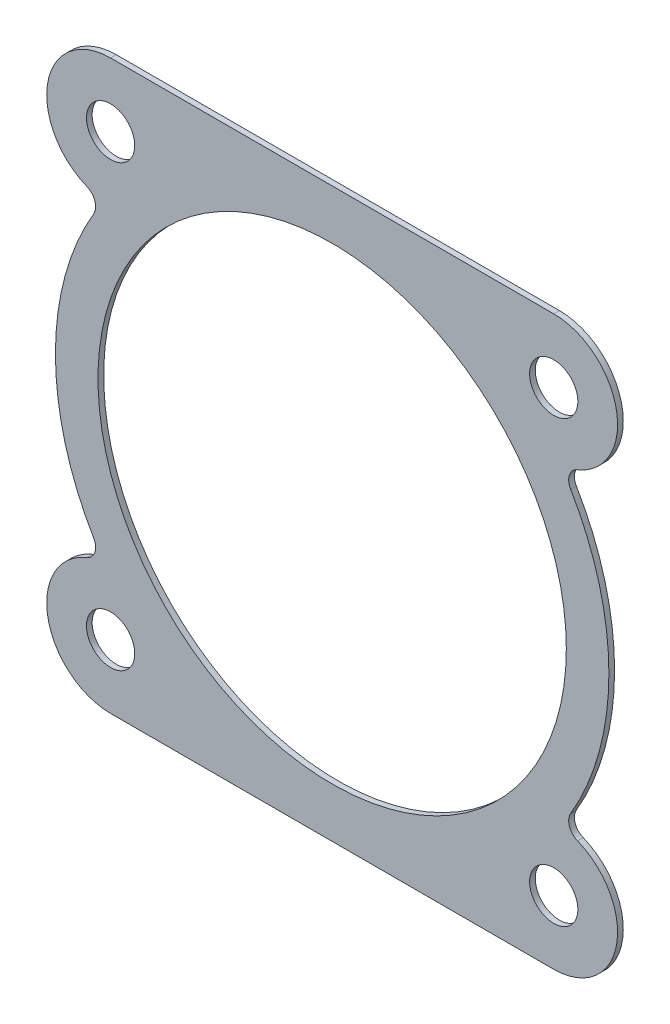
SolidWorks part; units mm, degrees
ref_plane "Plan1" through (0, 0, 0) normal (0, 0, 1) x (1, 0, 0)
ref_plane "Plan2" through (0, 0, 0) normal (0, 1, 0) x (1, 0, 0)
ref_plane "Plan3" through (0, 0, 0) normal (1, 0, 0) x (0, 0, -1)
sketch "Esquisse1" plane through (0, 0, 0) normal (0, 0, 1) x (1, 0, 0)
  line L0 (0, 24.7958) -> (0, -28.468) construction
  line L1 (15.6125, 20) -> (-15.6125, 20)
  line L2 (-15.6125, -20) -> (15.6125, -20)
  arc A0 (-16.8053, -9.891) -> (-16.8053, 9.891) centre (0, 0) cw
  arc A1 (17.2936, 11.3258) -> (15.6125, 20) centre (15.6125, 15.5) ccw
  arc A2 (-16.8053, -9.891) -> (-17.2936, -11.3258) centre (-17.6671, -10.3982) cw
  arc A3 (17.2936, 11.3258) -> (16.8053, 9.891) centre (17.6671, 10.3982) ccw
  arc A4 (-15.6125, -20) -> (-17.2936, -11.3258) centre (-15.6125, -15.5) cw
  arc A5 (-17.2936, 11.3258) -> (-16.8053, 9.891) centre (-17.6671, 10.3982) cw
  arc A6 (-17.2936, 11.3258) -> (-15.6125, 20) centre (-15.6125, 15.5) cw
  arc A7 (15.6125, -20) -> (17.2936, -11.3258) centre (15.6125, -15.5) ccw
  arc A8 (16.8053, -9.891) -> (17.2936, -11.3258) centre (17.6671, -10.3982) ccw
  arc A9 (16.8053, -9.891) -> (16.8053, 9.891) centre (0, 0) ccw
  point P27 (0, 20)
  dimension "D1" = 4.5
  dimension "D2" = 19.5
  dimension "D3" = 4.5
  dimension "D4" = 1
  dimension "D5" = 1
  dimension "D14" = 15.5
  dimension "D15" = 15.6125
  dimension "D6" = 20
  dimension "D8" = 15.6125
  dimension "D9" = 15.5
  dimension "D10" = 17.6671
  dimension "D11" = 10.3982
  dimension "D12" = 17.6671
  dimension "D13" = 10.3982
extrude "Base-Extrusion" add sketch "Esquisse1" along normal mid plane 0.4
hole_wizard "Perçage1" positions "Esquisse3" profile "Esquisse2" hole size "M3" standard "ISO"
sketch "Esquisse3" plane through (0, 0, 0.2) normal (0, 0, 1) x (1, 0, 0)
  arc A0 (17.2936, 11.3258) -> (15.6125, 20) centre (15.6125, 15.5) ccw construction
  arc A2 (-15.6125, 20) -> (-17.2936, 11.3258) centre (-15.6125, 15.5) ccw construction
  arc A3 (-17.2936, -11.3258) -> (-15.6125, -20) centre (-15.6125, -15.5) ccw construction
  arc A4 (15.6125, -20) -> (17.2936, -11.3258) centre (15.6125, -15.5) ccw construction
  point P0 (15.6125, 15.5)
  point P1 (-15.6125, 15.5)
  point P3 (-15.6125, -15.5)
  point P4 (15.6125, -15.5)
sketch "Esquisse2" plane through (15.6125, 15.5, 0.2) normal (1, 0, 0) x (0, -1, 0)
  line L0 (0, 0) -> (0, 0.4)
  line L1 (0, 0.4) -> (1.7, 0.4)
  line L2 (1.7, 0.4) -> (1.7, 0)
  line L5 (1.7, 0) -> (0, 0)
  line L11 (0, -6.35) -> (0, 107.95) construction
  dimension "Diamètre du perçage jusqu'au prochain" = 3.4
  dimension "Profondeur du perçage jusqu'au prochain" = 0.4
sketch "Esquisse4" plane through (0, 0, 0.2) normal (0, 0, 1) x (1, 0, 0)
  circle A0 centre (0, 0) radius 16.5
  dimension "D1" = 33
extrude "Enlèv. mat.-Extru.1" cut sketch "Esquisse4" against normal through all
